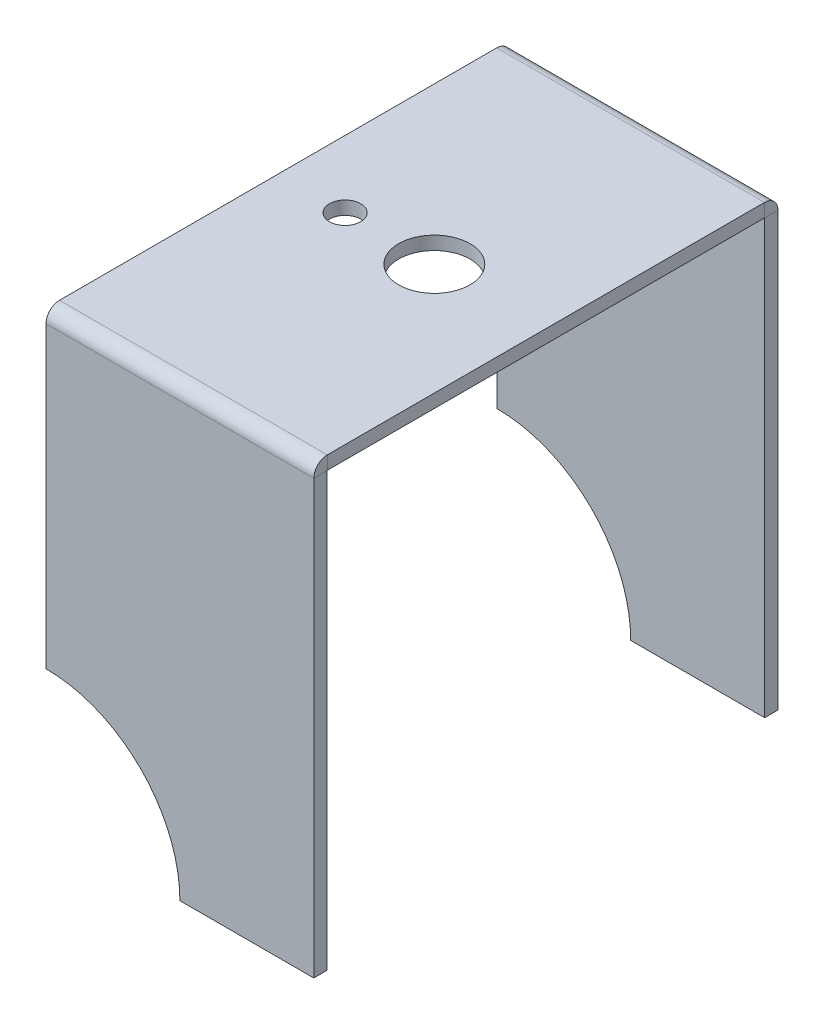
SolidWorks part; units mm, degrees
ref_plane "Front" through (0, 0, 0) normal (0, 0, 1) x (1, 0, 0)
ref_plane "Top" through (0, 0, 0) normal (0, 1, 0) x (1, 0, 0)
ref_plane "Right" through (0, 0, 0) normal (1, 0, 0) x (0, 0, -1)
sketch "Sketch1" plane through (0, 0, 0) normal (0, 1, 0) x (1, 0, 0)
  line L1 (0, 0) -> (-15, 0)
  line L2 (0, 0) -> (0, 152)
  line L3 (0, 152) -> (-15, 152)
  line L4 (-30, 15) -> (-30, 137)
  arc A0 (-30, 137) -> (-15, 152) centre (-30, 152) ccw
  arc A1 (-15, 0) -> (-30, 15) centre (-30, 0) ccw
  circle A2 centre (-12.5, 76) radius 4
  circle A3 centre (-22.5, 76) radius 1.75
  dimension "D1" = 10
  dimension "D2" = 12.5
sheet metal parameters "Sheet-Metal1" thickness 1.5 parameters "D1"=0.01
base flange "Base-Flange1" sketch "Sketch1" thickness 1.5 reverse thickness direction yes parameters "D1"=0.01
sketch "Sketch3" plane through (0, 1.5, 0) normal (0, 1, 0) x (-1, 0, 0)
  line L3 (30, -50) -> (0, -50)
  line L4 (30, -102) -> (0, -102)
sketched bend "Sketched Bend1" parameters "D1"=0
bend "SketchBend1" bend radius 0.01 bend angle 90 parameters "D5"=1
bend "SketchBend2" bend radius 0 bend angle 90 parameters "D5"=2
flat pattern "Flat-Pattern1"
sketch "Bend-Lines1" plane through (0, 1.5, 0) normal (0, 1, 0) x (-1, 0, 0)
  line L0 (0, -102) -> (30, -102) construction
  line L1 (0, -50) -> (30, -50) construction
bend of the flat pattern "Flatten-<SketchBend1>1"
bend of the flat pattern "Flatten-<SketchBend2>1"
